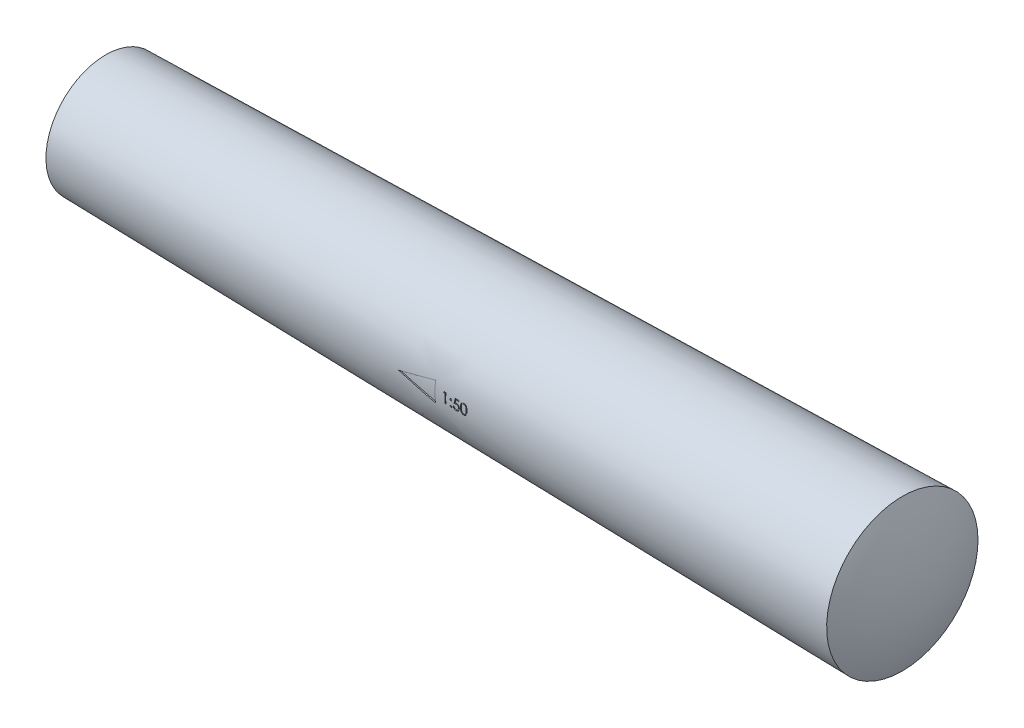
SolidWorks part; units mm, degrees
ref_plane "Front Plane" through (0, 0, 0) normal (0, 0, 1) x (1, 0, 0)
ref_plane "Top Plane" through (0, 0, 0) normal (0, 1, 0) x (1, 0, 0)
ref_plane "Right Plane" through (0, 0, 0) normal (1, 0, 0) x (0, 0, -1)
sketch "Sketch1" plane through (0, 0, 0) normal (1, 0, 0) x (0, 0, -1)
  circle A0 centre (0, 0) radius 6
  dimension "D1" = 12
extrude "Extrude1" add sketch "Sketch1" along normal mid plane 80
draft "Draft1" type of draft neutral plane draft angle 1.146 faces to draft 1 parameters "D1"=1.146
sketch "Sketch2" plane through (0, 0, 0) normal (0, 0, 1) x (1, 0, 0)
  line L0 (-40, 0) -> (-40, 6)
  line L1 (-40, 6) -> (-40, -6) construction
  line L2 (-40, 0) -> (-41.6, 0)
  line L3 (-41.6, 0) -> (-41.6, -6.8) construction
  line L4 (40, 0) -> (40, 7.6001)
  line L5 (40, -7.6001) -> (40, 7.6001) construction
  line L6 (40, 0) -> (41.6, 0)
  line L7 (41.6, 0) -> (41.6, -6.8) construction
  line L8 (-40, -6) -> (40, -7.6001) construction
  arc A0 (-41.6, 0) -> (-40, 6) centre (-29.55, 0) cw
  arc A1 (41.6, 0) -> (40, 7.6001) centre (22.7498, 0) ccw
  point P14 (0, -6.8)
revolve "Revolve1" add sketch "Sketch2" angle 360 about L2
sketch "Sketch5" plane through (0, 0, 0) normal (0, 0, 1) x (1, 0, 0)
  line L0 (0, 6.8) -> (0, -6.8) construction
  line L1 (40, 7.6001) -> (-40, 6) construction
  line L2 (-40, -6) -> (40, -7.6001) construction
ref_plane "Plane2" through (0, 0, 0) normal (-0.02, 0, 0.9998) x (0.9998, 0, 0.02)
sketch "Sketch6" plane through (0, 0, 0) normal (-0.02, 0, 0.9998) x (0.9998, 0, 0.02)
  line L0 (0, 0) -> (0, 1)
  line L1 (0, 6.8) -> (0, -6.8) construction
  line L2 (0, 1) -> (-3.7321, 0)
  line L3 (-3.7321, 0) -> (0, -1)
  line L4 (0, -1) -> (0, 0)
  line L5 (0, -0.5) -> (4, -0.5) construction
  text T0 "1:50" font "Century Gothic" height 1
  dimension "D1" = 2
  dimension "D2" = 30
  dimension "D3" = 4
wrap "Wrap2" sketch "Sketch6" wrap type deboss source sketch "Sketch6" thickness 0.1 parameters "D1"=0.1
equation "\"D2@Sketch2\" = \"D1@Sketch2\""
